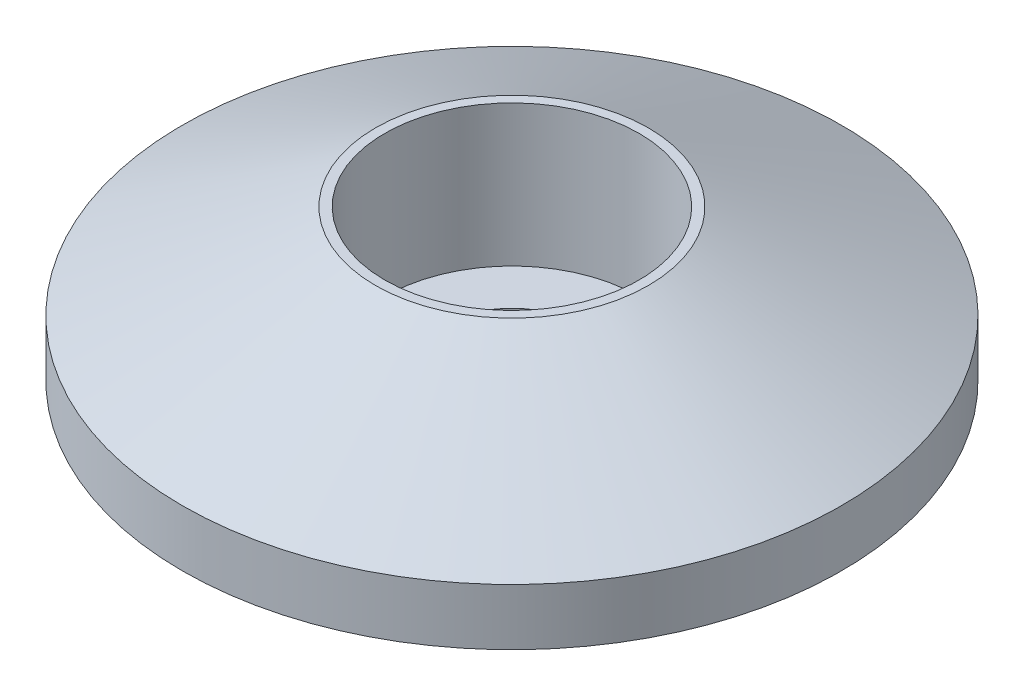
SolidWorks part; units mm, degrees
ref_plane "Plan de face" through (0, 0, 0) normal (0, 0, 1) x (1, 0, 0)
ref_plane "Plan de dessus" through (0, 0, 0) normal (0, 1, 0) x (1, 0, 0)
ref_plane "Plan de droite" through (0, 0, 0) normal (1, 0, 0) x (0, 0, -1)
sketch "Esquisse1" plane through (0, 0, 0) normal (0, 1, 0) x (1, 0, 0)
  line L0 (11.6875, 0) -> (-9.7978, 0) construction
  circle A0 centre (0, 0) radius 7
  circle A1 centre (0, 0) radius 1.6
extrude "Extrusion1" add sketch "Esquisse1" along normal blind 3.2
sketch "Esquisse2" plane through (0, 3.2, 0) normal (0, 1, 0) x (-1, 0, 0)
  circle A0 centre (0, 0) radius 2.7
extrude "Enlèv. mat.-Extru.1" cut sketch "Esquisse2" against normal blind 3
chamfer "Chanfrein1" distance 2 angle 64 1 edges at (0, 3.2, 7)
